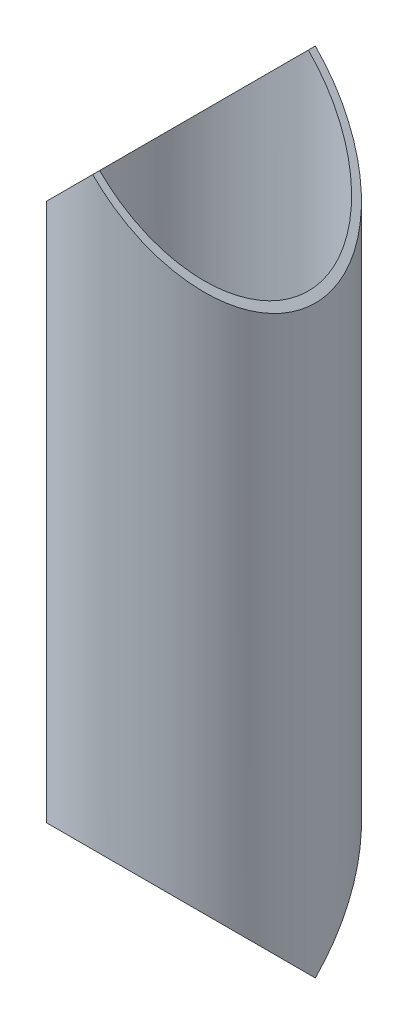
SolidWorks part; units mm, degrees
ref_plane "Front Plane" through (0, 0, 0) normal (0, 0, 1) x (1, 0, 0)
ref_plane "Top Plane" through (0, 0, 0) normal (0, 1, 0) x (1, 0, 0)
ref_plane "Right Plane" through (0, 0, 0) normal (1, 0, 0) x (0, 0, -1)
sketch "Sketch1" plane through (0, 0, 0) normal (0, 1, 0) x (1, 0, 0)
  circle A0 centre (0, 0) radius 25.4
  circle A1 centre (0, 0) radius 23.8125
  dimension "D1" = 50.8
  dimension "D2" = 1.5875
extrude "Boss-Extrude1" add sketch "Sketch1" along normal blind 158.75
sketch "Sketch2" plane through (0, 0, 0) normal (0, 0, 1) x (1, 0, 0)
  line L2 (-25.4, 158.75) -> (-25.4, 0) construction
  line L3 (25.4, 0) -> (25.4, 158.75) construction
  line L4 (25.4, 133.35) -> (25.4, 158.75)
  line L5 (25.4, 158.75) -> (-0.9601, 166.5405)
  line L6 (-0.9601, 166.5405) -> (-25.4, 158.75)
  line L7 (-25.4, 158.75) -> (-25.4, 133.35)
  line L9 (-25.4, 133.35) -> (0, 158.75)
  line L10 (0, 158.75) -> (25.4, 133.35)
  line L11 (25.4, 158.75) -> (-25.4, 158.75) construction
extrude "Cut-Extrude1" cut sketch "Sketch2" against normal through all and the other way through all
sketch "Sketch3" plane through (0, 0, 0) normal (1, 0, 0) x (0, 0, -1)
  line L0 (-25.4, 158.75) -> (-25.4, 0) construction
  line L1 (25.4, 0) -> (25.4, 158.75) construction
  line L2 (-25.4, 25.4) -> (-25.4, 0)
  line L3 (-25.4, 0) -> (0.0326, -12.1128)
  line L4 (0.0326, -12.1128) -> (25.4, 0)
  line L5 (25.4, 0) -> (25.4, 25.4)
  line L7 (25.4, 25.4) -> (0, 0)
  line L8 (-23.8125, 0) -> (23.8125, 0) construction
  line L9 (0, 0) -> (-25.4, 25.4)
extrude "Cut-Extrude2" cut sketch "Sketch3" against normal through all and the other way through all
